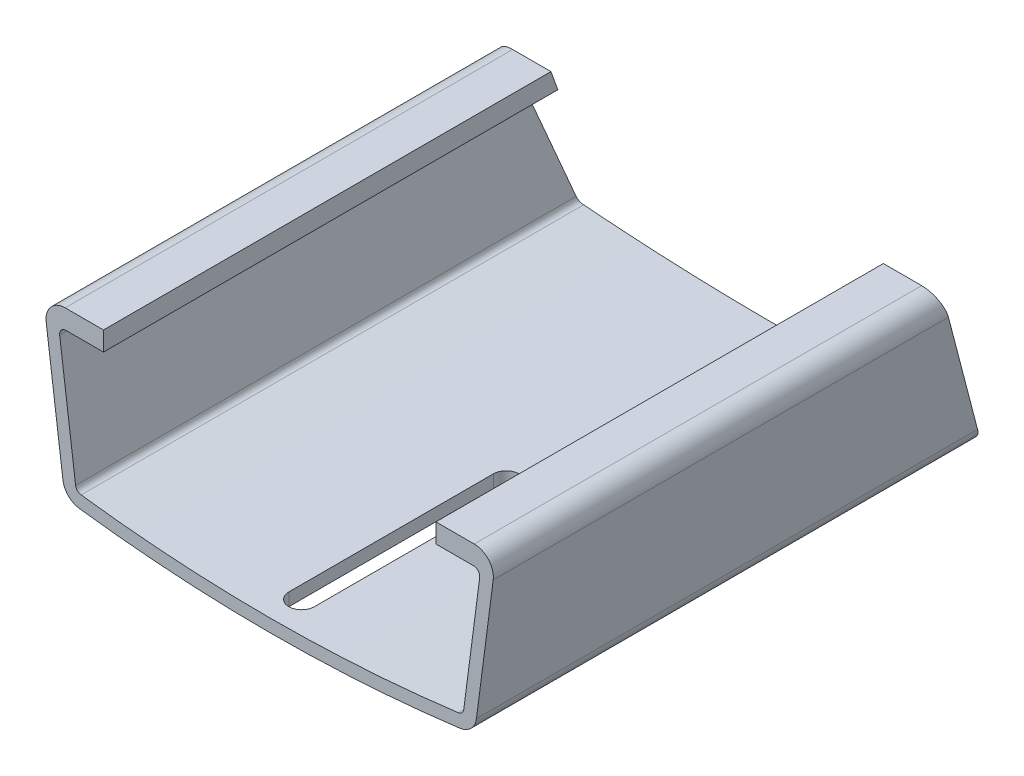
SolidWorks part; units mm, degrees
ref_plane "Plan1" through (0, 0, 0) normal (0, 0, 1) x (1, 0, 0)
ref_plane "Plan2" through (0, 0, 0) normal (0, 1, 0) x (1, 0, 0)
ref_plane "Plan3" through (0, 0, 0) normal (1, 0, 0) x (0, 0, -1)
sketch "Esquisse1" plane through (0, 0, 0) normal (0, 0, 1) x (1, 0, 0)
  line L0 (-30, 0) -> (30, 0) construction
  line L1 (30.3603, 2.7623) -> (32.8527, 21.8707)
  line L2 (-30.3603, 2.7623) -> (-32.8527, 21.8707)
  line L3 (0, 0) -> (0, -230) construction
  line L4 (0, -230) -> (30, 0) construction
  line L5 (0, -230) -> (-30, 0) construction
  line L6 (33, 23) -> (0, 23) construction
  line L7 (-33, 23) -> (0, 23) construction
  line L8 (-32.3435, 2.5036) -> (-35.4082, 26)
  line L9 (32.3435, 2.5036) -> (35.4082, 26)
  line L10 (31.8611, 23) -> (26, 23)
  line L11 (26, 23) -> (26, 26)
  line L12 (26, 26) -> (35.4082, 26)
  line L13 (-31.8611, 23) -> (-26, 23)
  line L14 (-26, 23) -> (-26, 26)
  line L15 (-26, 26) -> (-35.4082, 26)
  arc A0 (-29.497, 1.8999) -> (29.497, 1.8999) centre (0, 229.9301) ccw
  arc A1 (-29.7536, -0.0836) -> (29.7536, -0.0836) centre (0, 229.9301) ccw
  arc A2 (-30.3603, 2.7623) -> (-29.497, 1.8999) centre (-29.3687, 2.8916) ccw
  arc A3 (-31.8611, 23) -> (-32.8527, 21.8707) centre (-31.8611, 22) ccw
  arc A4 (31.8611, 23) -> (32.8527, 21.8707) centre (31.8611, 22) cw
  arc A5 (29.497, 1.8999) -> (30.3603, 2.7623) centre (29.3687, 2.8916) ccw
  arc A6 (32.3435, 2.5036) -> (29.7536, -0.0836) centre (29.3687, 2.8916) cw
  arc A7 (-32.3435, 2.5036) -> (-29.7536, -0.0836) centre (-29.3687, 2.8916) ccw
  point P29 (30.2609, 2)
  dimension "D8" = 1
  dimension "D9" = 3
  dimension "D1" = 23
  dimension "D2" = 66
  dimension "D3" = 60
  dimension "D4" = 21
  dimension "D6" = 52
  dimension "D7" = 3
  dimension "D5" = 2
extrude "Base-Extrusion" add sketch "Esquisse1" along normal blind 80
fillet "Congé1" radius 3
sketch "Esquisse2" plane through (0, 26, 0) normal (0, 1, 0) x (-1, 0, 0)
  line L0 (0, 80) -> (0, 0) construction
  line L1 (2, 75) -> (2, 43)
  line L2 (-2, 75) -> (-2, 43)
  line L3 (29.497, 80) -> (-29.497, 80) construction
  arc A0 (2, 75) -> (-2, 75) centre (0, 75) ccw
  arc A1 (-2, 43) -> (2, 43) centre (0, 43) ccw
  dimension "D1" = 2
  dimension "D2" = 32
  dimension "D3" = 5
extrude "Enlèv. mat.-Extru.1" cut sketch "Esquisse2" against normal through all
sketch "Esquisse3" plane through (0, 0, 0) normal (1, 0, 0) x (0, 0, -1)
  line L0 (0, 26) -> (-10, 26)
  line L1 (-80, 26) -> (0, 26) construction
  line L2 (0, 26) -> (0, -2)
  line L3 (-10, 26) -> (0, -2)
  line L4 (-41, -2) -> (0, -2) construction
  dimension "D1" = 10
extrude "Enlèv. mat.-Extru.2" cut sketch "Esquisse3" against normal through all and the other way through all
